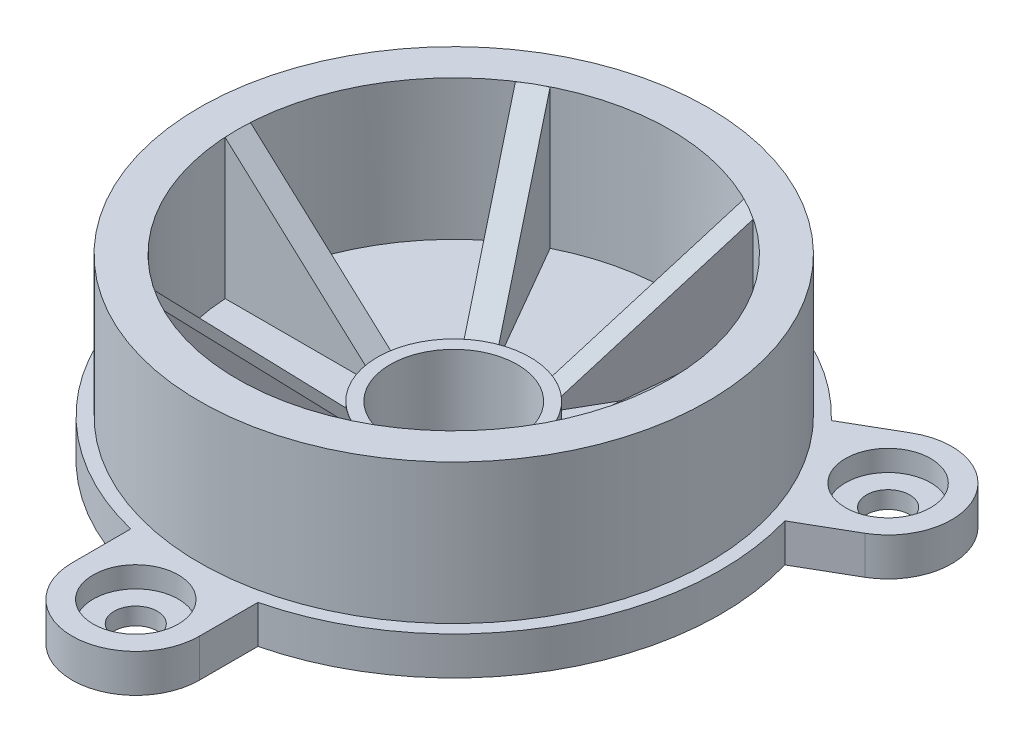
SolidWorks part; units mm, degrees
ref_plane "Front Plane" through (0, 0, 0) normal (0, 0, 1) x (1, 0, 0)
ref_plane "Top Plane" through (0, 0, 0) normal (0, 1, 0) x (1, 0, 0)
ref_plane "Right Plane" through (0, 0, 0) normal (1, 0, 0) x (0, 0, -1)
sketch "Sketch1" plane through (0, 0, 0) normal (1, 0, 0) x (0, 0, -1)
  line L0 (0, 0) -> (0, 43.5809) construction
  line L1 (5, 0) -> (10, 0)
  line L2 (10, 0) -> (10, 2)
  line L3 (10, 2) -> (21, 2)
  line L4 (21, 2) -> (21, 5)
  line L5 (21, 5) -> (20, 5)
  line L6 (20, 5) -> (20, 16)
  line L7 (20, 16) -> (17, 16)
  line L8 (17, 16) -> (17, 5)
  line L9 (17, 5) -> (6, 5)
  line L10 (6, 5) -> (6, 6)
  line L11 (6, 6) -> (5, 6)
  line L12 (5, 6) -> (5, 0)
  dimension "D1" = 10
  dimension "D2" = 20
  dimension "D3" = 42
  dimension "D4" = 3
  dimension "D5" = 2
  dimension "D6" = 1
  dimension "D7" = 11
  dimension "D8" = 12
  dimension "D9" = 34
  dimension "D10" = 40
revolve "Revolve1" add sketch "Sketch1" angle 360 about L0
sketch "Sketch2" plane through (0, 5, 0) normal (0, 1, 0) x (1, 0, 0)
  line L0 (0, 0) -> (0, -25) construction
  line L1 (-5, -20.3961) -> (-5, -25)
  line L2 (5, -20.3961) -> (5, -25)
  line L3 (-5, 0) -> (-5, -25) construction
  line L4 (5, 0) -> (5, -25) construction
  circle A0 centre (0, 0) radius 21 construction
  arc A1 (-5, -20.3961) -> (5, -20.3961) centre (0, 0) ccw
  circle A2 centre (0, 0) radius 25 construction
  arc A3 (-5, -25) -> (5, -25) centre (0, -25) ccw
  dimension "D1" = 50
  dimension "D2" = 5
extrude "Extrude1" add sketch "Sketch2" against normal up to surface (3 mm away)
hole_wizard "CBORE for M3 SBHCS1" positions "Sketch4" profile "Sketch3" counterbore size "M3" standard "Ansi Metric"
sketch "Sketch4" plane through (0, 5, 0) normal (0, 1, 0) x (-1, 0, 0)
  arc A0 (5, 25) -> (-5, 25) centre (0, 25) ccw construction
  point P0 (0, 25)
sketch "Sketch3" plane through (0, 5, 25) normal (1, 0, 0) x (0, 0, 1)
  line L0 (0, 0) -> (0, 5)
  line L1 (0, 5) -> (1.7, 5)
  line L3 (1.7, 5) -> (1.7, 1.65)
  line L4 (1.7, 1.65) -> (3.35, 1.65)
  line L5 (3.35, 1.65) -> (3.35, 0)
  line L7 (3.35, 0) -> (0, 0)
  line L11 (0, -6.35) -> (0, 107.95) construction
  dimension "Thru Hole Dia." = 3.4
  dimension "Thru Hole Depth" = 5
  dimension "C'Bore Dia." = 6.7
  dimension "C'Bore Depth" = 1.65
pattern_circular "CirPattern1" count 3 over 360 about axis through (0, 0, 0) along (0, 1, 0) of "CBORE for M3 SBHCS1", "Extrude1"
sketch "Sketch5" plane through (0, 0, 0) normal (0, 0, 1) x (1, 0, 0)
  line L0 (-17, 16) -> (-6, 6)
rib "Rib1" sketch "Sketch5" sketch "Sketch5" thickness 2 extrusion direction parallel to sketch draft on no parameters "D1"=2
pattern_circular "CirPattern2" count 6 over 360 about axis through (0, 0, 0) along (0, 1, 0) of "Rib1"
